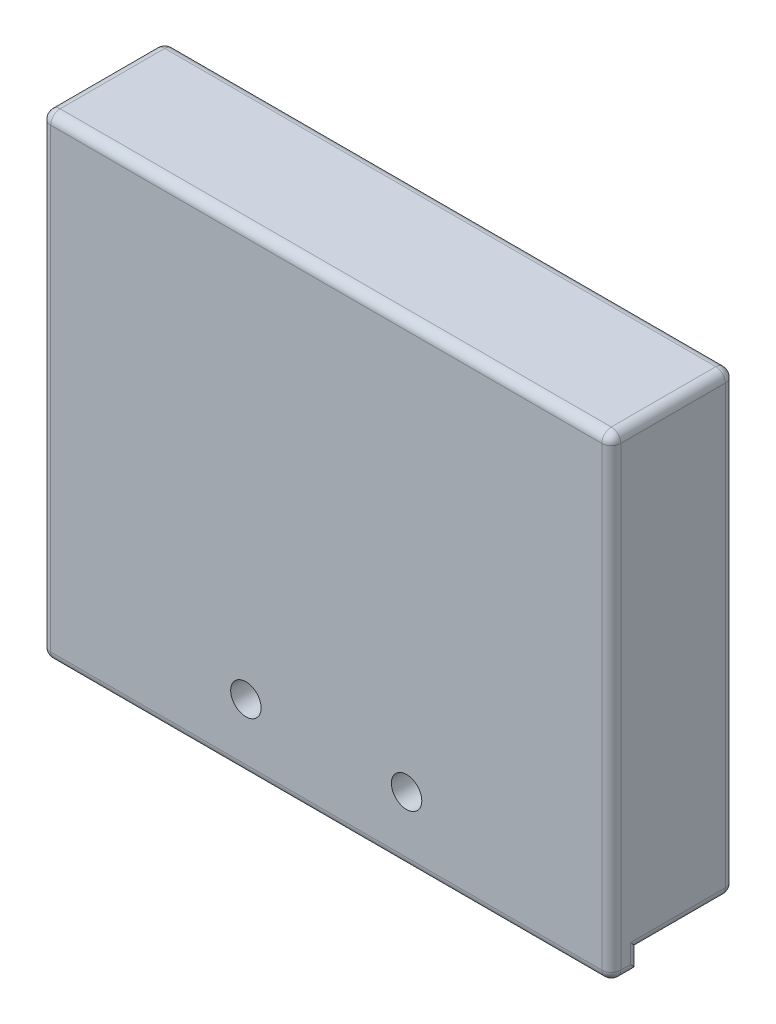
SolidWorks part; units mm, degrees
ref_plane "Ebene vorne" through (0, 0, 0) normal (0, 0, 1) x (1, 0, 0)
ref_plane "Ebene oben" through (0, 0, 0) normal (0, 1, 0) x (1, 0, 0)
ref_plane "Ebene rechts" through (0, 0, 0) normal (1, 0, 0) x (0, 0, -1)
sketch "Skizze1" plane through (0, 0, 0) normal (0, 0, 1) x (1, 0, 0)
  line L0 (-8.455, -18.04) -> (8.455, -18.04) construction
  line L1 (-30, -25) -> (30, -25)
  line L2 (-30, -25) -> (-30, 25)
  line L3 (-30, 25) -> (30, 25)
  line L4 (30, -25) -> (30, 25)
  line L5 (-30, -25) -> (30, 25) construction
  line L6 (-30, 25) -> (30, -25) construction
  circle A0 centre (-8.455, -18.04) radius 1.6
  circle A1 centre (8.455, -18.04) radius 1.6
  point P0 (0, 0)
  point P10 (0, 0)
  point P11 (0, -18.04)
  dimension "D5" = 3.2
  dimension "D6" = 3.2
  dimension "D1" = 16.91
  dimension "D2" = 6.96
  dimension "D3" = 60
  dimension "D4" = 50
extrude "Aufsatz-Linear austragen1" add sketch "Skizze1" along normal blind 3
sketch "Skizze2" plane through (0, 0, 0) normal (0, 0, -1) x (-1, 0, 0)
  line L0 (-30, 25) -> (-30, -23)
  line L2 (30, -23) -> (30, 25)
  line L3 (30, 25) -> (-30, 25)
  line L4 (28, 23) -> (-28, 23)
  line L5 (-28, 23) -> (-28, -23)
  line L7 (28, -23) -> (28, 23)
  line L8 (-28, -23) -> (-30, -23)
  line L9 (28, -23) -> (30, -23)
  line L10 (-30, 25) -> (-30, -25) construction
  line L11 (30, -25) -> (30, 25) construction
  line L12 (-30, -25) -> (30, -25) construction
  line L13 (-28, -23) -> (28, -23) construction
  line L14 (30, -25) -> (-30, -25) construction
  dimension "D2" = 2
  dimension "D1" = 2
extrude "Aufsatz-Linear austragen2" add sketch "Skizze2" along normal blind 10
fillet "Verrundung1" radius 1 4 edges at (0, -25, 3) (-30, 0, 3) (0, 25, 3) (30, 0, 3)
fillet "Verrundung2" radius 1 20 edges at (-29.7071, -24.7071, 2.7071) (-29.7071, 24.7071, 2.7071) (29.7071, -24.7071, 2.7071) (29.7071, 24.7071, 2.7071) (-29, -23, -10) (-28, 0, -10) (0, 23, -10) (28, 0, -10) (29, -23, -10) (-30, -24, 0) (-30, -23, -5) (-30, 1, -10) (-30, -25, 1) (0, 25, -10) (-30, 25, -4) (30, 1, -10) (30, -23, -5) (30, -24, 0) (30, -25, 1) (30, 25, -4)
